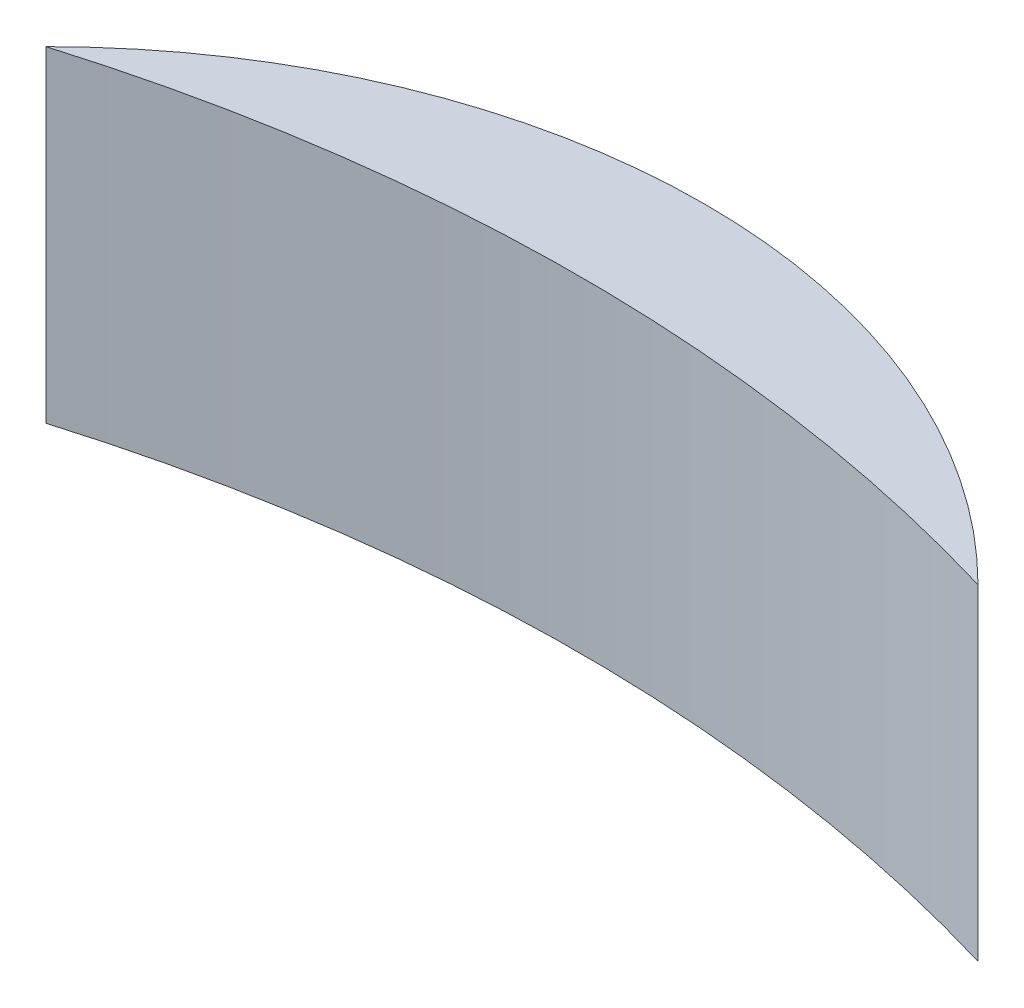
SolidWorks part; units mm, degrees
ref_plane "Front Plane" through (0, 0, 0) normal (0, 0, 1) x (1, 0, 0)
ref_plane "Top Plane" through (0, 0, 0) normal (0, 1, 0) x (1, 0, 0)
ref_plane "Right Plane" through (0, 0, 0) normal (1, 0, 0) x (0, 0, -1)
sketch "Sketch1" plane through (0, 0, 0) normal (0, 1, 0) x (1, 0, 0)
  line L0 (0, 0) -> (0, 76.2) construction
  arc A0 (-25.4, 0) -> (25.4, 0) centre (0, -25.4) cw
  arc A1 (-25.4, 0) -> (25.4, 0) centre (0, -85.1942) cw
  dimension "D3" = 35.921
  dimension "D4" = 88.9
  dimension "D1" = 50.8
extrude "Boss-Extrude1" add sketch "Sketch1" along normal blind 17.78 contours A0 A1
